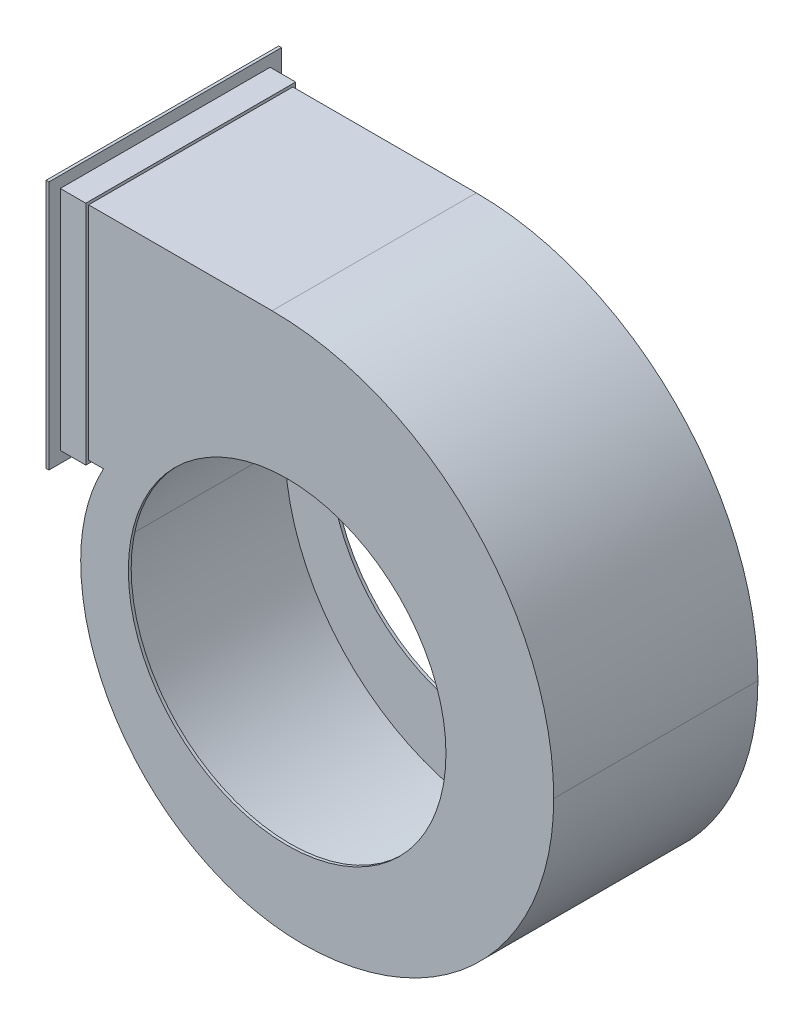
SolidWorks part; units mm, degrees
ref_plane "前视基准面" through (0, 0, 0) normal (0, 0, 1) x (1, 0, 0)
ref_plane "上视基准面" through (0, 0, 0) normal (0, 1, 0) x (1, 0, 0)
ref_plane "右视基准面" through (0, 0, 0) normal (1, 0, 0) x (0, 0, -1)
sketch "草图1" plane through (0, 0, 0) normal (0, 0, 1) x (1, 0, 0)
  line L5 (-26.5036, 523.0073) -> (-380, 523.0073)
  line L6 (-380, 523.0073) -> (-380, 133.0073)
  line L7 (-380, 133.0073) -> (-323.9095, 133.0073)
  arc A1 (-323.9095, 133.0073) -> (-363.9854, -26.5036) centre (-26.5036, -26.5036) ccw
  arc A2 (-363.9854, -26.5036) -> (26.5036, -416.9927) centre (26.5036, -26.5036) ccw
  arc A3 (26.5036, -416.9927) -> (470, 26.5036) centre (26.5036, 26.5036) ccw
  arc A4 (470, 26.5036) -> (-26.5036, 523.0073) centre (-26.5036, 26.5036) ccw
  dimension "D1" = 337.4818
  dimension "D3" = 850
  dimension "D5" = 390.4891
  dimension "D6" = 470
  dimension "D7" = 133.0073
  dimension "D4" = 390
  dimension "D2" = 940
extrude "拉伸1" add sketch "草图1" along normal mid plane 360
shell "抽壳1" thickness 5
sketch "草图2" plane through (0, 0, 180) normal (0, 0, 1) x (1, 0, 0)
  circle A0 centre (0, 0) radius 280
  dimension "D1" = 560
extrude "拉伸2" cut sketch "草图2" against normal through all
sketch "草图3" plane through (-380, 0, 0) normal (-1, 0, 0) x (0, 0, 1)
  line L4 (180, 133.0073) -> (-180, 133.0073)
  line L5 (180, 523.0073) -> (180, 133.0073)
  line L6 (180, 523.0073) -> (-180, 523.0073)
  line L7 (-180, 523.0073) -> (-180, 133.0073)
  line L8 (185, 128.0073) -> (-185, 128.0073)
  line L9 (-185, 528.0073) -> (-185, 128.0073)
  line L10 (185, 528.0073) -> (-185, 528.0073)
  line L11 (185, 528.0073) -> (185, 128.0073)
  line L19 (-180, 523.0073) -> (-180, 133.0073) construction
  line L20 (180, 133.0073) -> (-180, 133.0073) construction
  line L21 (180, 523.0073) -> (180, 133.0073) construction
  line L22 (180, 523.0073) -> (-180, 523.0073) construction
  dimension "D1" = 5
extrude "拉伸3" add sketch "草图3" against normal blind 30 and the other way blind 20 separate body
sketch "草图4" plane through (-400, 0, 0) normal (-1, 0, 0) x (0, 0, 1)
  line L0 (-185, 528.0073) -> (-185, 128.0073) construction
  line L1 (185, 528.0073) -> (-185, 528.0073) construction
  line L2 (185, 128.0073) -> (185, 528.0073) construction
  line L3 (-185, 128.0073) -> (185, 128.0073) construction
  line L4 (-185, 528.0073) -> (-185, 128.0073)
  line L5 (185, 528.0073) -> (-185, 528.0073)
  line L6 (185, 128.0073) -> (185, 528.0073)
  line L7 (-185, 128.0073) -> (185, 128.0073)
  line L8 (-205, 548.0073) -> (-205, 108.0073)
  line L9 (-205, 108.0073) -> (205, 108.0073)
  line L10 (205, 108.0073) -> (205, 548.0073)
  line L11 (205, 548.0073) -> (-205, 548.0073)
  dimension "D1" = 20
extrude "拉伸4" add sketch "草图4" against normal blind 5
